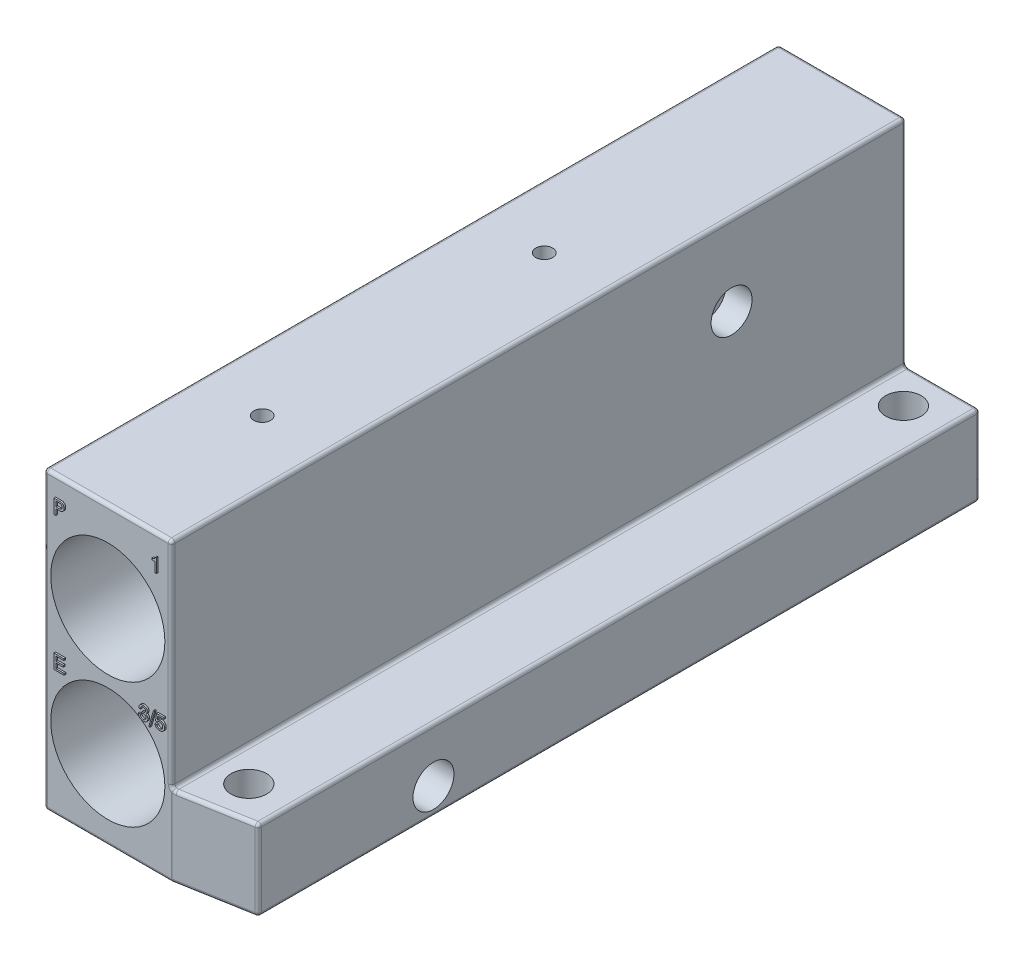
SolidWorks part; units mm, degrees
ref_plane "Front" through (0, 0, 0) normal (0, 0, 1) x (1, 0, 0)
ref_plane "Top" through (0, 0, 0) normal (0, 1, 0) x (1, 0, 0)
ref_plane "Right" through (0, 0, 0) normal (1, 0, 0) x (0, 0, -1)
sketch "Base_Sketch" plane through (0, 0, 0) normal (1, 0, 0) x (0, 0, -1)
  line L1 (-54.7, 44) -> (54.7, 44)
  line L2 (-54.7, 44) -> (-54.7, 0)
  line L3 (-54.7, 0) -> (54.7, 0)
  line L4 (54.7, 44) -> (54.7, 0)
  dimension "Length" = 109.4
  dimension "Height" = 44
extrude "Base" add sketch "Base_Sketch" along normal mid plane 19
sketch "Leg_Sketch" plane through (0, 0, 0) normal (0, -1, 0) x (1, 0, 0)
  line L0 (9.5, 54.7) -> (20.5, 52.7604)
  line L1 (20.5, 52.7604) -> (20.5, -54.7)
  line L4 (9.5, 54.7) -> (9.5, -54.7)
  line L5 (0, 0) -> (24.9985, 0) construction
  line L6 (-9.5, 54.7) -> (-9.5, -54.7) construction
  line L7 (9.5, -54.7) -> (20.5, -54.7)
  line L9 (9.5, -54.7) -> (9.5, 54.7) construction
  dimension "Width" = 30
  dimension "Back_Angle" = 90
  dimension "Front_Angle" = 80
  dimension "Loc Front" = 54.7
  dimension "Loc Back" = 54.7
extrude "Leg" add sketch "Leg_Sketch" against normal blind 12
sketch "Bottom Angle_Sketch" [suppressed] plane through (0, 0, 0) normal (1, 0, 0) x (0, 0, -1)
  line L0 (-56.1, 2.4686) -> (-42.1, 0)
  line L1 (-56.1, 46.8) -> (-56.1, 0) construction
  line L2 (40.8314, 0) -> (-50.7, 0) construction
  line L5 (40.8314, 0) -> (-50.7, 0) construction
  dimension "Dist" = 14
  dimension "Angle" = 10
extrude "Bottom Angle" [suppressed] cut sketch "Bottom Angle_Sketch" against normal through all and the other way through all flip side to cut
fillet "Rounds" radius 0.5 20 edges at (9.5, 44, 0) (20.5, 12, -0.9698) (20.5, 6, 52.7604) (20.5, 6, -54.7) (20.5, 0, -0.9698) (15, 0, 53.7302) (-9.5, 44, 0) (-9.5, 22, -54.7) (-9.5, 0, 0) (-9.5, 22, 54.7) (0, 44, 54.7) (0, 44, -54.7) (5.5, 0, -54.7) (0, 0, 54.7)
sketch "Adjuster Holes_Sketch" plane through (0, 0, 0) normal (0, 1, 0) x (1, 0, 0)
  line L1 (9.5, 54.7) -> (9.5, -54.7) construction
  line L2 (-9, 54.7) -> (9, 54.7) construction
  circle A0 centre (14.5, 49.3) radius 2.65
  circle A1 centre (14.5, -48.2) radius 2.65
  dimension "Dia" = 5.3
  dimension "C_2_C" = 97.5
  dimension "Loc_X" = 5
  dimension "Loc_Z" = 5.4
extrude "Adjuster Holes" cut sketch "Adjuster Holes_Sketch" along normal through all
sketch "Upper Guide_Sketch" plane through (9.5, 0, 0) normal (1, 0, 0) x (0, 0, -1)
  line L0 (54.7, 43.5) -> (54.7, 12.5) construction
  line L1 (-54.2, 44) -> (54.2, 44) construction
  circle A0 centre (28.7, 32) radius 3.05
  dimension "Dia" = 6.1
  dimension "Loc_Z" = 26
  dimension "Loc_Y" = 12
extrude "Upper Guide" cut sketch "Upper Guide_Sketch" against normal blind 3.85
sketch "Lower Guide_Sketch" plane through (20.5, 0, 0) normal (1, 0, 0) x (0, 0, -1)
  line L0 (-54.7, 12.5) -> (-54.7, 43.5) construction
  line L2 (54.2, 0) -> (-52.3409, 0) construction
  circle A0 centre (-26.7, 4) radius 3.05
  circle A1 centre (28.7, 32) radius 3.05 construction
  dimension "Loc_Z" = 28
  dimension "Loc_Y" = 4
extrude "Lower Guide" cut sketch "Lower Guide_Sketch" against normal up to surface (14.85 mm away)
sketch "Thread Hole_Sketch" plane through (5.65, 0, 0) normal (1, 0, 0) x (0, 0, -1)
  circle A0 centre (28.7, 32) radius 1.8
  circle A1 centre (-26.7, 4) radius 1.8
  circle A2 centre (-26.7, 4) radius 3.05 construction
  circle A3 centre (28.7, 32) radius 3.05 construction
  dimension "Dia" = 3.6
extrude "Thread Hole" cut sketch "Thread Hole_Sketch" against normal through all
sketch "Guides Inside_Sketch" plane through (-9.5, 0, 0) normal (-1, 0, 0) x (0, 0, 1)
  circle A0 centre (26.7, 4) radius 3.05 construction
  circle A1 centre (-28.7, 32) radius 3.05 construction
  circle A2 centre (26.7, 4) radius 3.05
  circle A3 centre (-28.7, 32) radius 3.05
extrude "Guides Inside" cut sketch "Guides Inside_Sketch" against normal blind 5.7
sketch "Cap Holes_Sketch" plane through (0, 44, 0) normal (0, 1, 0) x (-1, 0, 0)
  line L2 (-9, 54.7) -> (9, 54.7) construction
  circle A0 centre (0, 31.7) radius 1.25
  circle A1 centre (0, -10.3) radius 1.25
  dimension "Dia" = 2.5
  dimension "Loc_Z" = 23
  dimension "C_2_C" = 42
extrude "Cap Holes" cut sketch "Cap Holes_Sketch" against normal blind 6
sketch "Clamp Seat_Sketch" [suppressed] plane through (0, 0, 0) normal (0, -1, 0) x (1, 0, 0)
  line L0 (10, 50.7) -> (23, 50.7) construction
  line L3 (9.8, 49) -> (21.8, 49)
  line L4 (9.8, 49) -> (9.8, -41.5209)
  line L5 (9.8, -41.5209) -> (21.8, -39.405)
  line L6 (21.8, 49) -> (21.8, -39.405)
  line L7 (23.0868, -40.9043) -> (9.9132, -43.2271) construction
  line L8 (15.8, 49) -> (15.8, 50.7) construction
  line L9 (21.8, 4.7975) -> (23.5, 4.7975) construction
  line L10 (23.5, 42.0563) -> (23.5, -40.4119) construction
  line L11 (15.8, -40.4629) -> (16.0952, -42.1371) construction
  dimension "Wall" = 1.7
  dimension "Width" = 12
extrude "Clamp Seat" [suppressed] cut sketch "Clamp Seat_Sketch" against normal blind 10
sketch "Rail Groove_Sketch" [suppressed] plane through (0, 0, 0) normal (1, 0, 0) x (0, 0, -1)
  line L0 (-28.5, 0) -> (-28.5, 3.4473)
  line L1 (40.4119, 0) -> (-42.1, 0) construction
  line L2 (-28.5, 3.4473) -> (-30.5, 3.8)
  line L3 (-30.5, 3.8) -> (-30.5, 5.3)
  line L4 (-30.5, 5.3) -> (4.5, 5.3)
  line L5 (4.5, 5.3) -> (4.5, 0)
  line L6 (4.5, 0) -> (-28.5, 0)
  line L7 (56.1, 46.3) -> (56.1, 0.5) construction
  line L8 (-42.1, 0) -> (-50.2868, 1.4436) construction
  point P12 (-13, 5.3)
  dimension "Loc" = 69.1
  dimension "Width" = 35
  dimension "Groove_Height" = 1.5
  dimension "Bot_Width" = 33
  dimension "Height" = 5.3
extrude "Rail Groove" [suppressed] cut sketch "Rail Groove_Sketch" against normal through all and the other way through all
sketch "Fitting Holes_Sketch" plane through (0, 0, 54.7) normal (0, 0, 1) x (1, 0, 0)
  line L1 (-9, 0) -> (20, 0) construction
  line L7 (-9, 0) -> (20, 0) construction
  circle A0 centre (0, 30.6) radius 8.5
  circle A1 centre (0, 11.9) radius 8.5
  dimension "Dia" = 17
  dimension "Loc_Y-Bot" = 11.9
  dimension "Loc_Y-Top" = 30.6
extrude "Fitting Holes" cut sketch "Fitting Holes_Sketch" against normal blind 29.2
sketch "P_Sketch" plane through (0.7263, 0.415, 54.7) normal (0, 0, 1) x (1, 0, 0)
  line L0 (-10.2263, 0.085) -> (-10.2263, 43.085) construction
  line L1 (-9.7263, 43.585) -> (8.2737, 43.585) construction
  text T0 "P"
  dimension "Loc_X" = 1.5
  dimension "Loc_Y" = 5
extrude "P" add sketch "P_Sketch" along normal blind 0.25
sketch "1_Sketch" plane through (0, 0, 54.7) normal (0, 0, 1) x (1, 0, 0)
  line L0 (9.5, 43.5) -> (9.5, 12.5) construction
  text T0 "1"
  dimension "Loc_X" = 3
extrude "1" add sketch "1_Sketch" along normal up to surface (0.25 mm away)
sketch "E_Sketch" plane through (0, 0, 54.7) normal (0, 0, 1) x (1, 0, 0)
  line L0 (-9, 44) -> (9, 44) construction
  text T0 "E"
  dimension "Loc_Y" = 25
extrude "E" add sketch "E_Sketch" against normal up to surface (0.25 mm away)
sketch "35_Sketch" plane through (0, 0, 54.7) normal (0, 0, 1) x (1, 0, 0)
  line L0 (9.5, 43.5) -> (9.5, 12.5) construction
  text T0 "3/5"
  dimension "Loc_X" = 4.75
extrude "35" add sketch "35_Sketch" against normal up to surface (0.25 mm away)
sketch "Latch Cut_Sketch" [suppressed] plane through (0, 0, -56.1) normal (0, 0, -1) x (-1, 0, 0)
  line L0 (9.5, 46.3) -> (9.5, 0.5) construction
  line L1 (9.5, 34.8) -> (-0.5, 34.8)
  line L2 (9.5, 34.8) -> (9.5, 29.2)
  line L3 (9.5, 29.2) -> (-0.5, 29.2)
  line L4 (-0.5, 34.8) -> (-0.5, 29.2)
  line L5 (-9, 46.8) -> (9, 46.8) construction
  dimension "Width" = 10
  dimension "Height" = 5.6
  dimension "Loc_Y" = 12
extrude "Latch Cut" [suppressed] cut sketch "Latch Cut_Sketch" against normal blind 4.6
sketch "Latch_Sketch" [suppressed] plane through (0, 29.2, 0) normal (0, 1, 0) x (-1, 0, 0)
  line L0 (9.25, -51.5) -> (9.25, -55.85)
  line L1 (9.25, -55.85) -> (3.45, -55.85)
  line L2 (9.5, -51.5) -> (9.5, -55.6) construction
  line L3 (9.5, 55.6) -> (9.5, -55.6) construction
  line L4 (9, -56.1) -> (-9, -56.1) construction
  line L5 (-0.5, -51.5) -> (9.5, -51.5) construction
  line L6 (6.35, -55.85) -> (6.35, -56.1) construction
  line L7 (9.25, -53.675) -> (9.5, -53.675) construction
  dimension "Offset" = 0.25
  dimension "Length" = 5.8
extrude "Latch" [suppressed] add sketch "Latch_Sketch" against normal up to surface (5.6 mm away) thin
